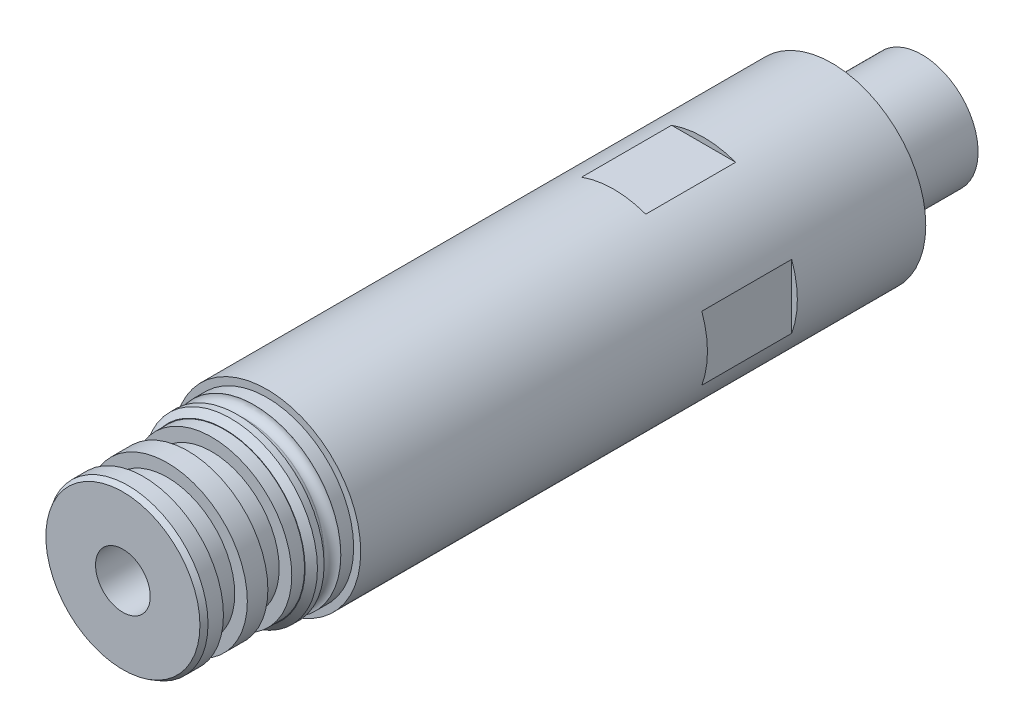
SolidWorks part; units mm, degrees
ref_plane "Plane1" through (0, 0, 0) normal (0, 0, 1) x (1, 0, 0)
ref_plane "Plane2" through (0, 0, 0) normal (0, 1, 0) x (1, 0, 0)
ref_plane "Plane3" through (0, 0, 0) normal (1, 0, 0) x (0, 0, -1)
sketch "Sketch1" plane through (0, 0, 0) normal (0, 0, 1) x (1, 0, 0)
  circle A0 centre (0, 0) radius 9.271
  dimension "D1" = 18.542
extrude "Base-Extrude" add sketch "Sketch1" along normal blind 55.88
sketch "Sketch2" plane through (0, 0, 0) normal (0, 0, -1) x (-1, 0, 0)
  circle A0 centre (0, 0) radius 5.5562
  dimension "D1" = 11.1125
extrude "threaded_base" add sketch "Sketch2" along normal blind 8.89
sketch "Sketch5"
  circle A0 centre (0, 0) radius 8.5725
  dimension "D1" = 17.145
extrude "thru_hole" cut sketch "Sketch3" against normal through all
sketch "Sketch3" plane through (0, 0, -8.89) normal (0, 0, -1) x (-1, 0, 0)
  circle A0 centre (0, 0) radius 1.5875
  dimension "D1" = 3.175
extrude "ortman_base" add sketch "Sketch5" along normal blind 1.27
sketch "Sketch6" plane through (0, 0, 57.15) normal (0, 0, 1) x (1, 0, 0)
  circle A0 centre (0, 0) radius 7.747
  dimension "D1" = 15.494
extrude "ortman_groove" add sketch "Sketch6" along normal blind 1.651
sketch "Sketch7" plane through (0, 0, 58.801) normal (0, 0, 1) x (1, 0, 0)
  circle A0 centre (0, 0) radius 8.5725
  dimension "D1" = 17.145
extrude "ortman_2" add sketch "Sketch7" along normal blind 1.27
fillet "ortman_fillet" radius 0.8128
sketch "Sketch8" plane through (0, 0, 60.071) normal (0, 0, 1) x (1, 0, 0)
  circle A0 centre (0, 0) radius 7.9121
  dimension "D1" = 15.8242
extrude "oring_base" add sketch "Sketch8" along normal blind 1.27
sketch "Sketch9" plane through (0, 0, 61.341) normal (0, 0, 1) x (1, 0, 0)
  circle A0 centre (0, 0) radius 6.6675
  dimension "D1" = 13.335
extrude "oring_groove" add sketch "Sketch9" along normal blind 2.3622
sketch "Sketch10" plane through (0, 0, 63.7032) normal (0, 0, 1) x (1, 0, 0)
  circle A0 centre (0, 0) radius 7.9121
  dimension "D1" = 15.8242
extrude "oring_base2" add sketch "Sketch10" along normal blind 2.032
sketch "Sketch12" plane through (0, 0, 65.7352) normal (0, 0, 1) x (1, 0, 0)
  circle A0 centre (0, 0) radius 6.6675
  dimension "D1" = 13.335
extrude "oring_groove_2" add sketch "Sketch12" along normal blind 2.3622
sketch "Sketch13" plane through (0, 0, 68.0974) normal (0, 0, 1) x (1, 0, 0)
  circle A0 centre (0, 0) radius 7.9121
  dimension "D1" = 15.8242
extrude "oring_base_3" add sketch "Sketch13" along normal blind 2.032
chamfer "Chamfer2" distance 0.508 angle 30
sketch "Sketch14" plane through (0, 0, 70.1294) normal (0, 0, 1) x (1, 0, 0)
  circle A0 centre (0, 0) radius 2.7051
  dimension "D1" = 5.4102
extrude "Cut-Extrude1" cut sketch "Sketch14" against normal blind 15.24
ref_plane "mill_plane" through (0, 0, 12.7) normal (0, 0, 1) x (1, 0, 0)
sketch "Sketch15" plane through (0, 0, 12.7) normal (0, 0, 1) x (1, 0, 0)
  line L0 (0, 0) -> (0, 8.7122) construction
  line L1 (0, 0) -> (8.7122, 0) construction
  line L2 (0, 8.7122) -> (8.7122, 8.7122)
  line L3 (8.7122, -8.7122) -> (8.7122, 8.7122)
  line L4 (-8.7122, -8.7122) -> (-8.7122, 8.7122)
  line L5 (0, 8.7122) -> (-8.7122, 8.7122)
  line L6 (0, -8.7122) -> (-8.7122, -8.7122)
  line L7 (0, -8.7122) -> (8.7122, -8.7122)
  point P8 (-8.7122, 0)
  dimension "D1" = 8.7122
  dimension "D2" = 8.7122
extrude "Cut-Extrude2" cut sketch "Sketch15" along normal blind 8.89 flip side to cut
chamfer "Chamfer4" distance 0.6096 angle 45
sketch "Sketch16" plane through (0, 0, 0) normal (0, 0, -1) x (-1, 0, 0)
  circle A0 centre (0, 0) radius 4.6228
  dimension "D1" = 9.2456
extrude "boss_seat" cut sketch "Sketch16" along normal blind 1.905 flip side to cut
fillet "boss_radius" radius 0.7874
